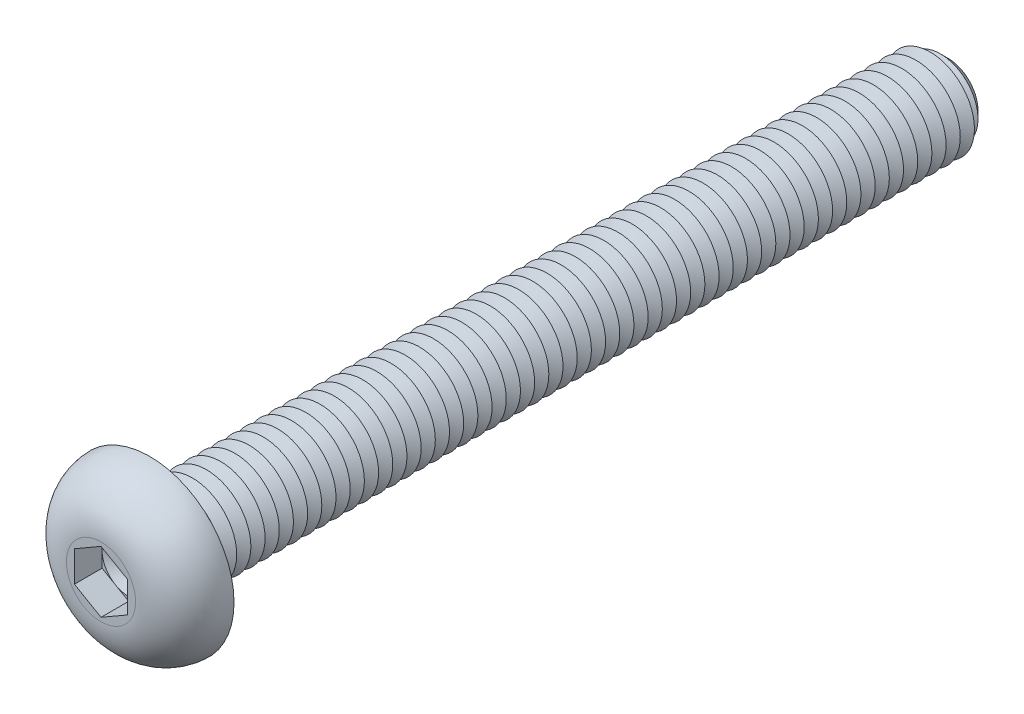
SolidWorks part; units mm, degrees
ref_plane "Front Plane" through (0, 0, 0) normal (0, 0, 1) x (1, 0, 0)
ref_plane "Top Plane" through (0, 0, 0) normal (0, 1, 0) x (1, 0, 0)
ref_plane "Right Plane" through (0, 0, 0) normal (1, 0, 0) x (0, 0, -1)
sketch "Sketch1" plane through (0, 0, 0) normal (1, 0, 0) x (0, 0, -1)
  line L0 (-47.9342, 0) -> (60.3146, 0) construction
sketch "Sketch2" plane through (0, 0, 0) normal (1, 0, 0) x (0, 0, -1)
  line L0 (0, 0) -> (-2.75, 0)
  line L1 (-47.9342, 0) -> (60.3146, 0) construction
  line L2 (-2.75, 0) -> (-2.75, 1.9504)
  line L3 (0, 4.75) -> (0, 0)
  arc A0 (-2.75, 1.9504) -> (0, 4.75) centre (0.05, 1.9504) cw
  dimension "D1" = 2.8
  dimension "D2" = 2.75
  dimension "D3" = 4.75
revolve "Revolve1" add sketch "Sketch2" angle 360 about L0
sketch "Sketch3" plane through (0, 0, 2.75) normal (0, 0, 1) x (1, 0, 0)
  line L1 (0, 1.7321) -> (-1.5, 0.866)
  line L2 (-1.5, 0.866) -> (-1.5, -0.866)
  line L3 (-1.5, -0.866) -> (0, -1.7321)
  line L4 (0, -1.7321) -> (1.5, -0.866)
  line L5 (1.5, -0.866) -> (1.5, 0.866)
  line L6 (1.5, 0.866) -> (0, 1.7321)
  circle A0 centre (0, 0) radius 1.5 construction
  dimension "D1" = 3
extrude "Cut-Extrude1" cut sketch "Sketch3" against normal blind 1.56
sketch "Sketch4" plane through (0, 0, 0) normal (0, 0, -1) x (-1, 0, 0)
  circle A0 centre (0, 0) radius 2.5
  dimension "D1" = 5
extrude "Boss-Extrude1" add sketch "Sketch4" along normal blind 45
chamfer "Chamfer1" distance 0.8 angle 45 1 edges at (-2.5, 0, -45)
sketch "Sketch5" plane through (0, 0, 0) normal (1, 0, 0) x (0, 0, -1)
  line L0 (0.8, 2.5) -> (1.6, 2.5)
  line L1 (44.2, 2.5) -> (0, 2.5) construction
  line L2 (1.6, 2.5) -> (1.2, 1.8072)
  line L3 (1.2, 1.8072) -> (0.8, 2.5)
  line L4 (0, -4.75) -> (0, 4.75) construction
  line L5 (44.2, 2.5) -> (0, 2.5) construction
  dimension "D1" = 0.8
  dimension "D2" = 0.8
revolve "Cut-Revolve1" cut sketch "Sketch5" angle 360 about L0
pattern_linear "LPattern1" count 55 spacing 0.8 along (0, 0, -1) of "Cut-Revolve1"
fillet "Fillet2" radius 0.4 1 edges at (2.5, 0, 0)
sketch "Sketch6" plane through (0, 0, 1.19) normal (0, 0, 1) x (1, 0, 0)
  line L0 (0, -1.7321) -> (1.5, -0.866) construction
  circle A0 centre (0, 0) radius 1.5
extrude "Cut-Extrude2" cut sketch "Sketch6" against normal through all draft 60
